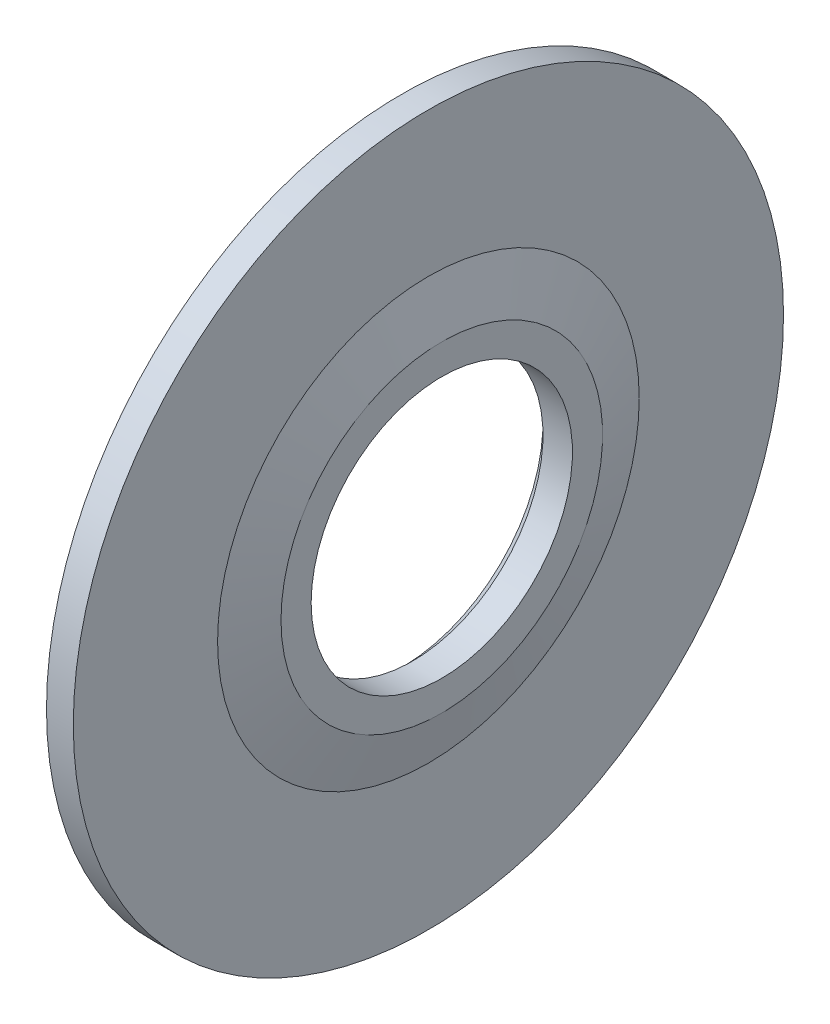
SolidWorks part; units mm, degrees
ref_plane "Plan de face" through (0, 0, 0) normal (0, 0, 1) x (1, 0, 0)
ref_plane "Plan de dessus" through (0, 0, 0) normal (0, 1, 0) x (1, 0, 0)
ref_plane "Plan de droite" through (0, 0, 0) normal (1, 0, 0) x (0, 0, -1)
sketch "Esquisse1" plane through (0, 0, 0) normal (0, 0, 1) x (1, 0, 0)
  line L0 (0, 0) -> (23.9606, 0) construction
  line L1 (0, 105.5) -> (0, 265)
  line L2 (0, 265) -> (20, 265)
  line L3 (20, 265) -> (20, 157.3205)
  line L4 (20, 157.3205) -> (30, 120)
  line L5 (30, 120) -> (30, 97.5)
  line L6 (30, 97.5) -> (8, 97.5)
  line L7 (8, 97.5) -> (0, 105.5)
  dimension "D1" = 265
  dimension "D2" = 135
  dimension "D3" = 8
  dimension "D4" = 20
  dimension "D5" = 165
  dimension "D6" = 120
  dimension "D7" = 30
  dimension "D8" = 97.5
revolve "Révolution1" add sketch "Esquisse1" angle 360 about L0
